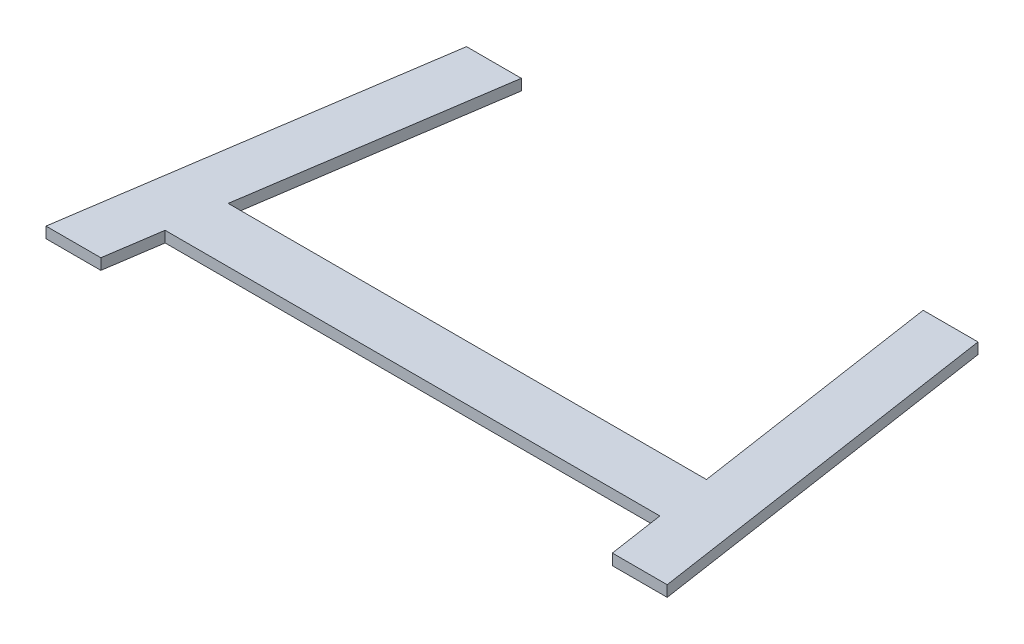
SolidWorks part; units mm, degrees
ref_plane "Front" through (0, 0, 0) normal (0, 0, 1) x (1, 0, 0)
ref_plane "Top" through (0, 0, 0) normal (0, 1, 0) x (1, 0, 0)
ref_plane "Right" through (0, 0, 0) normal (1, 0, 0) x (0, 0, -1)
sketch "Sketch1" plane through (0, 0, 0) normal (0, 1, 0) x (1, 0, 0)
  line L0 (-248.0717, 0) -> (528.634, 0) construction
  line L1 (-30, 200) -> (30, 200)
  line L5 (-11.8292, -78.8611) -> (511.3692, -78.8611)
  line L6 (249.77, 246.9073) -> (249.77, -459.5347) construction
  line L7 (0, 246.9073) -> (0, -263.5413) construction
  line L8 (-187.7593, 200) -> (505.0974, 200) construction
  line L9 (-248.0717, -200) -> (493.3291, -200) construction
  line L10 (-30, 200) -> (-90, -200)
  line L11 (-90, -200) -> (-30, -200)
  line L12 (30, 200) -> (-11.8292, -78.8611)
  line L14 (520.3692, -138.8611) -> (-20.8292, -138.8611)
  line L15 (-30, -200) -> (-20.8292, -138.8611)
  line L16 (589.54, -200) -> (529.54, -200)
  line L17 (529.54, -200) -> (520.3692, -138.8611)
  line L18 (469.54, 200) -> (511.3692, -78.8611)
  line L19 (529.54, 200) -> (469.54, 200)
  line L20 (529.54, 200) -> (589.54, -200)
  point P0 (0, 0)
  dimension "D1" = 559.54
  dimension "D2" = 60
  dimension "D3" = 60
extrude "Boss-Extrude1" add sketch "Sketch1" along normal blind 12
